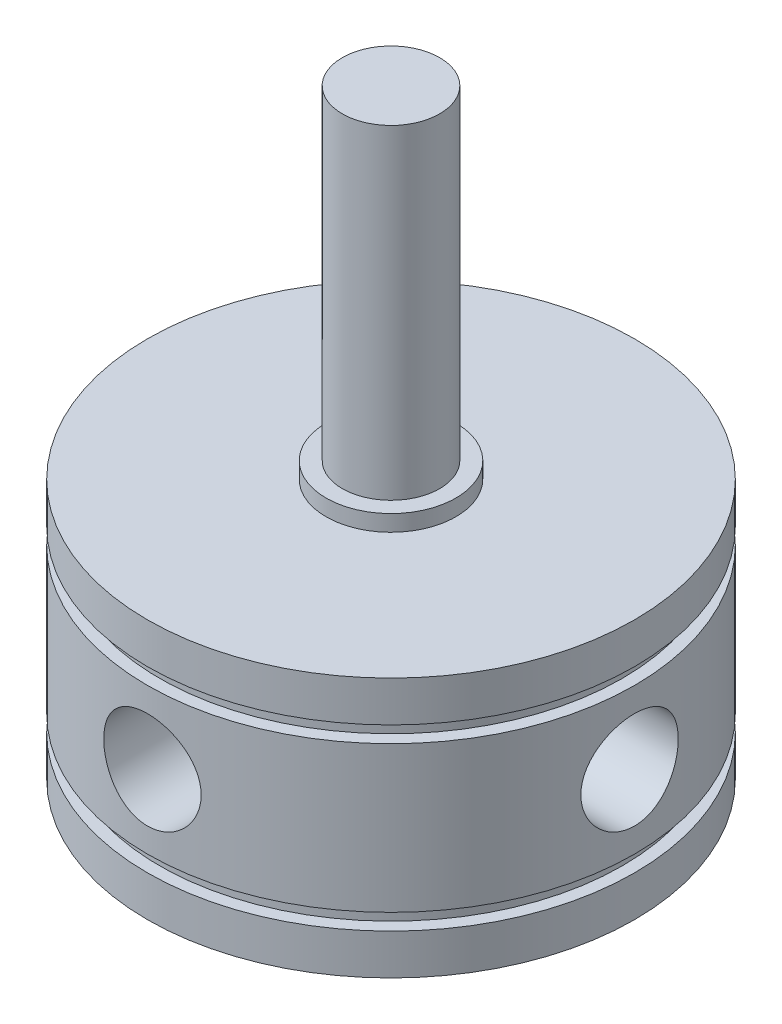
SolidWorks part; units mm, degrees
ref_plane "Plano frontal" through (0, 0, 0) normal (0, 0, 1) x (1, 0, 0)
ref_plane "Plano superior" through (0, 0, 0) normal (0, 1, 0) x (1, 0, 0)
ref_plane "Plano direito" through (0, 0, 0) normal (1, 0, 0) x (0, 0, -1)
sketch "Esboço2" plane through (0, 0, 0) normal (0, 0, 1) x (1, 0, 0)
  line L0 (0, 0) -> (0, 41)
  line L1 (0, 41) -> (3, 41)
  line L2 (3, 41) -> (3, 21)
  line L3 (3, 21) -> (4, 21)
  line L4 (4, 21) -> (4, 20)
  line L5 (4, 20) -> (15, 20)
  line L6 (15, 20) -> (15, 17.5)
  line L7 (15, 17.5) -> (14.25, 17.5)
  line L8 (14.25, 17.5) -> (14.25, 16.5)
  line L9 (14.25, 16.5) -> (15, 16.5)
  line L10 (15, 16.5) -> (15, 7.5)
  line L11 (15, 7.5) -> (14.25, 7.5)
  line L12 (14.25, 7.5) -> (14.25, 6.5)
  line L13 (14.25, 6.5) -> (15, 6.5)
  line L14 (15, 6.5) -> (15, 4)
  line L15 (15, 4) -> (4, 4)
  line L16 (4, 4) -> (4, 3)
  line L17 (4, 3) -> (3, 3)
  line L18 (3, 3) -> (3, 0)
  line L19 (3, 0) -> (0, 0)
  line L20 (0, 52.8834) -> (0, -8.8878) construction
  dimension "D1" = 41
  dimension "D2" = 16
  dimension "D3" = 3
  dimension "D4" = 1
  dimension "D5" = 1
  dimension "D6" = 20
  dimension "D7" = 3
  dimension "D8" = 3
  dimension "D9" = 11
  dimension "D10" = 2.5
  dimension "D11" = 0.75
  dimension "D12" = 1
  dimension "D13" = 4
revolve "Revolução" add sketch "Esboço2" angle 360 about L20
ref_plane "Plano1" through (15, 0, 0) normal (1, 0, 0) x (0, 0, -1)
sketch "Esboço3" plane through (15, 0, 0) normal (1, 0, 0) x (0, 0, -1)
  circle A0 centre (0, 12) radius 3
  dimension "D1" = 6
extrude "Furo perpendicular" cut sketch "Esboço3" against normal through all
ref_plane "Plano2" through (0, 0, 15) normal (0, 0, 1) x (0, 1, 0)
sketch "Esboço4" plane through (0, 0, 15) normal (0, 0, 1) x (0, 1, 0)
  line L0 (4, 15) -> (4, -15) construction
  circle A0 centre (12, 0) radius 3
  dimension "D2" = 6
  dimension "D1" = 8
ref_plane "Plano3" through (0, 12, 0) normal (0, 1, 0) x (1, 0, 0)
sketch "Esboço5" plane through (0, 12, 0) normal (0, 1, 0) x (1, 0, 0)
  line L0 (0, -15) -> (0, 0)
  line L1 (0, 0) -> (7.6577, 16.422)
  line L2 (0, 0) -> (0, 15.1453) construction
  dimension "D1" = 25
sweep "Furo desviado a 25 graus" cut profiles "Esboço4" path "Esboço5"
